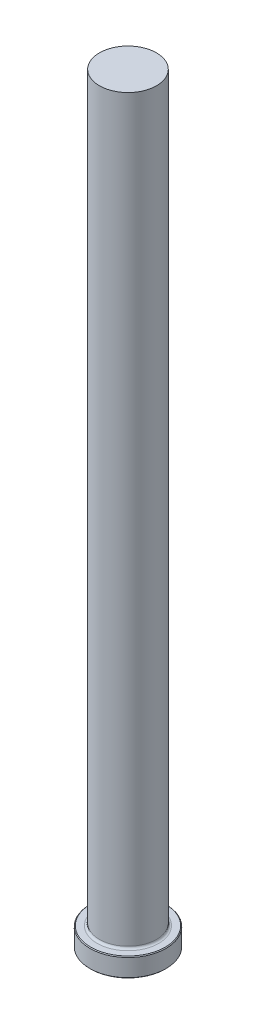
SolidWorks part; units mm, degrees
ref_plane "Front Plane" through (0, 0, 0) normal (0, 0, 1) x (1, 0, 0)
ref_plane "Top Plane" through (0, 0, 0) normal (0, 1, 0) x (1, 0, 0)
ref_plane "Right Plane" through (0, 0, 0) normal (1, 0, 0) x (0, 0, -1)
sketch "Sketch1" plane through (0, 0, 0) normal (0, 0, 1) x (1, 0, 0)
  line L0 (0, 259.9588) -> (0, -15.1925) construction
  line L1 (0, 0) -> (-12.7, 0)
  line L2 (-12.7, 0) -> (-12.7, 6.35)
  line L3 (-12.7, 6.35) -> (-9.525, 6.35)
  line L4 (-9.525, 6.35) -> (-9.525, 254)
  line L5 (-9.525, 254) -> (0, 254)
  line L6 (0, 254) -> (0, 0)
  dimension "L" = 254
  dimension "H" = 25.4
  dimension "T" = 6.35
  dimension "D" = 19.05
revolve "Revolve1" add sketch "Sketch1" angle 360 about L0
chamfer "Chamfer1" distance 0.254 angle 45 2 edges at (0, 6.35, 12.7) (0, 0, 12.7)
fillet "Fillet1" radius 0.762 1 edges at (0, 6.35, 9.525)
sketch "Pocket Sketch" plane through (0, 0, 0) normal (0, 0, 1) x (1, 0, 0)
  line L0 (-13.0969, 0) -> (-13.0969, 6.3754)
  line L1 (-13.0969, 6.3754) -> (-10.6839, 6.3754)
  line L2 (-9.9219, 7.1374) -> (-9.9219, 22.225)
  line L3 (-9.9219, 22.225) -> (0, 22.225)
  line L4 (0, 22.225) -> (0, 0)
  line L5 (0, 0) -> (-13.0969, 0)
  line L6 (0, 12.6104) -> (0, -2.4989) construction
  line L7 (-12.7, 6.096) -> (-12.7, 0.254) construction
  line L8 (12.446, 6.35) -> (-12.446, 6.35) construction
  line L9 (-9.525, 254) -> (-9.525, 7.112) construction
  line L10 (-10.6839, 6.3754) -> (-9.9219, 7.1374)
  point P3 (-9.9219, 6.3754)
  dimension "D1" = 26.1937
  dimension "D2" = 0.3969
  dimension "D3" = 0.0254
  dimension "D4" = 0.3969
  dimension "D5" = 19.8437
  dimension "D6" = 22.225
